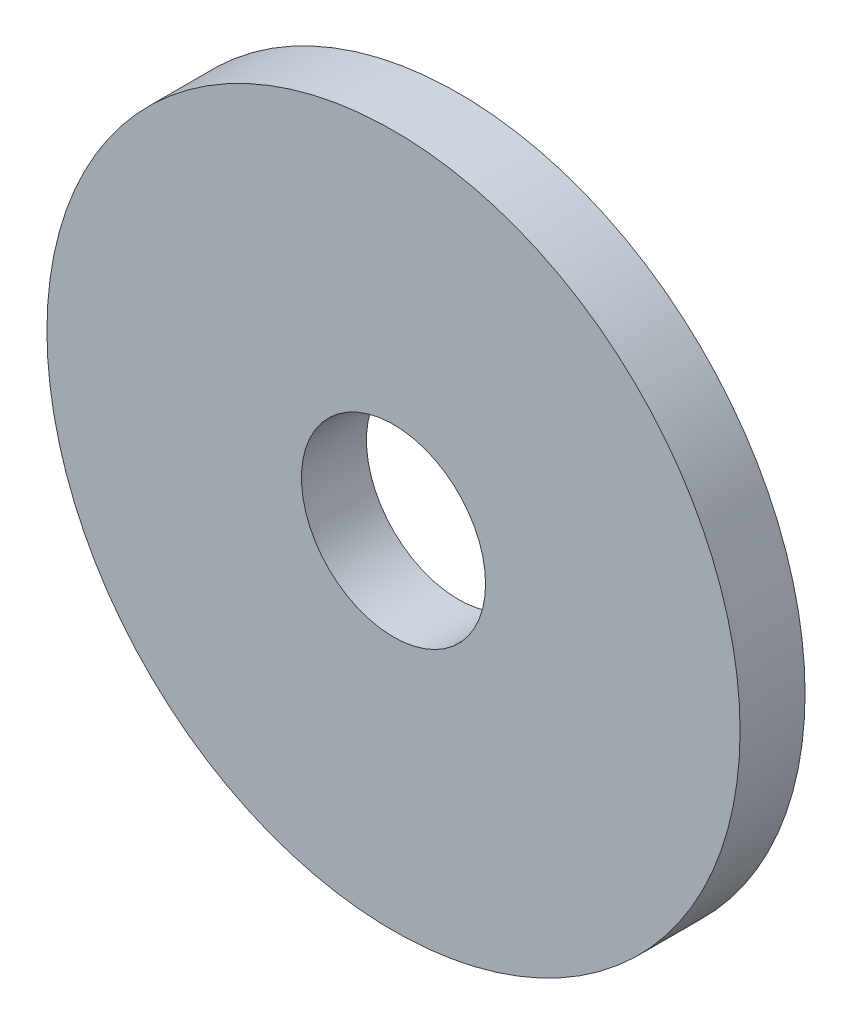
SolidWorks part; units mm, degrees
ref_plane "Plan de face" through (0, 0, 0) normal (0, 0, 1) x (1, 0, 0)
ref_plane "Plan de dessus" through (0, 0, 0) normal (0, 1, 0) x (1, 0, 0)
ref_plane "Plan de droite" through (0, 0, 0) normal (1, 0, 0) x (0, 0, -1)
sketch "Esquisse1" plane through (0, 0, 0) normal (0, 0, 1) x (1, 0, 0)
  circle A0 centre (0, 0) radius 16
  circle A1 centre (0, 0) radius 4.25
  dimension "D1" = 32
  dimension "D2" = 8.5
extrude "Boss.-Extru.1" add sketch "Esquisse1" along normal blind 3
